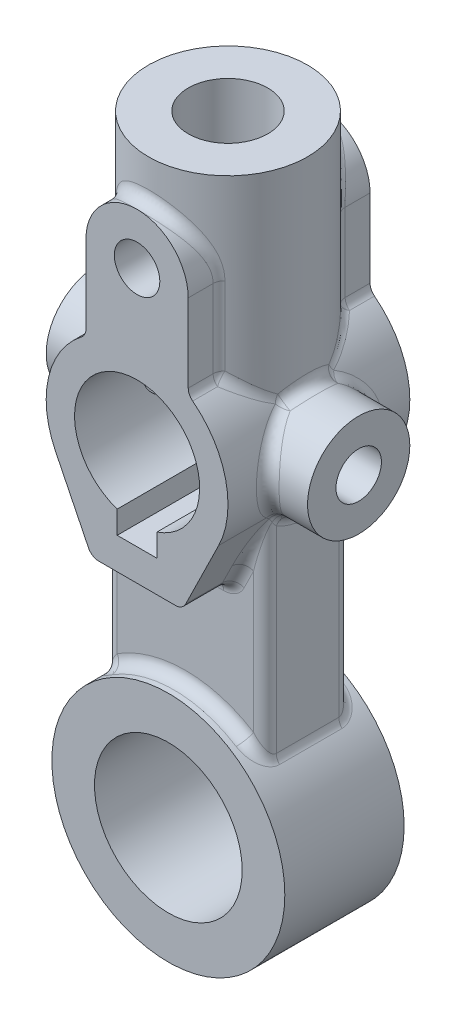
SolidWorks part; units mm, degrees
ref_plane "Front" through (0, 0, 0) normal (0, 0, 1) x (1, 0, 0)
ref_plane "Top" through (0, 0, 0) normal (0, 1, 0) x (1, 0, 0)
ref_plane "Right" through (0, 0, 0) normal (1, 0, 0) x (0, 0, -1)
sketch "Sketch1" plane through (0, 0, 0) normal (0, 0, 1) x (1, 0, 0)
  line L0 (0, 0) -> (0, 44.45) construction
  line L1 (14.2875, 21.0007) -> (14.2875, 44.45)
  line L2 (-14.2875, 21.0007) -> (-14.2875, 44.45)
  line L3 (-12.7, -31.75) -> (12.7, -31.75)
  line L4 (12.7, -31.75) -> (22.7967, -11.2013)
  line L5 (-12.7, -31.75) -> (-22.7967, -11.2013)
  line L6 (0, 0) -> (0, -31.75) construction
  arc A0 (22.7967, -11.2013) -> (14.2875, 21.0007) centre (0, 0) ccw
  arc A1 (-14.2875, 44.45) -> (14.2875, 44.45) centre (0, 44.45) cw
  arc A2 (-14.2875, 21.0007) -> (-22.7967, -11.2013) centre (0, 0) ccw
  dimension "D1" = 14.2875
  dimension "D2" = 44.45
  dimension "D3" = 50.8
  dimension "D4" = 31.75
  dimension "D5" = 25.4
extrude "Base-Extrude" add sketch "Sketch1" along normal mid plane 50.8
sketch "Sketch2" plane through (0, 0, 0) normal (0, 1, 0) x (1, 0, 0)
  circle A0 centre (0, 0) radius 22.225
  dimension "D1" = 44.45
extrude "Boss-Extrude1" add sketch "Sketch2" along normal blind 69.85
sketch "Sketch3" plane through (0, 0, 0) normal (0, 1, 0) x (1, 0, 0)
  line L0 (0, 0) -> (22.225, 0) construction
  line L1 (-22.225, 11.9062) -> (22.225, 11.9062)
  line L2 (-22.225, 11.9062) -> (-22.225, -11.9062)
  line L3 (-22.225, -11.9062) -> (22.225, -11.9062)
  line L4 (22.225, 11.9062) -> (22.225, -11.9062)
  circle A0 centre (0, 0) radius 22.225 construction
  dimension "D1" = 23.8125
extrude "Boss-Extrude2" add sketch "Sketch3" against normal blind 95.25
sketch "Sketch4" plane through (0, 0, 0) normal (0, 0, 1) x (1, 0, 0)
  line L0 (0, 69.85) -> (0, 21.0007) construction
  line L1 (-22.225, -95.25) -> (22.225, -95.25) construction
  circle A0 centre (0, -95.25) radius 32.5437
  dimension "D1" = 65.0875
extrude "Boss-Extrude3" add sketch "Sketch4" along normal mid plane 33.3375
sketch "Sketch5" plane through (0, 0, 0) normal (1, 0, 0) x (0, 0, -1)
  circle A0 centre (0, 0) radius 14.2875
  dimension "D1" = 28.575
extrude "Boss-Extrude4" add sketch "Sketch5" along normal mid plane 73.025
sketch "Sketch7" plane through (0, 0, 0) normal (0, 0, 1) x (1, 0, 0)
  line L0 (0, 0) -> (0, -22.9184) construction
  line L1 (0, 69.85) -> (0, 13.3293) construction
  line L2 (-5.5563, -22.9184) -> (5.5562, -22.9184)
  line L3 (5.5562, -22.9184) -> (5.5562, -16.5684)
  line L4 (-5.5563, -22.9184) -> (-5.5563, -16.5684)
  arc A0 (5.5562, -16.5684) -> (-5.5563, -16.5684) centre (0, 0) ccw
  dimension "D1" = 34.9504
  dimension "D2" = 11.1125
  dimension "D3" = 6.35
extrude "Cut-Extrude2" cut sketch "Sketch7" against normal through all and the other way through all
sketch "Sketch10" plane through (0, 0, 0) normal (0, 0, 1) x (1, 0, 0)
  line L0 (0, 69.85) -> (0, 13.3293) construction
  circle A0 centre (0, 44.45) radius 6.35
  arc A1 (14.2875, 44.45) -> (-14.2875, 44.45) centre (0, 44.45) ccw construction
  dimension "D1" = 12.7
extrude "Cut-Extrude5" cut sketch "Sketch10" against normal through all and the other way through all
sketch "Sketch6" plane through (0, 0, 0) normal (1, 0, 0) x (0, 0, -1)
  circle A0 centre (0, 0) radius 6.35
  dimension "D1" = 12.7
extrude "Cut-Extrude1" cut sketch "Sketch6" against normal through all and the other way through all
sketch "Sketch8" plane through (0, 69.85, 0) normal (0, 1, 0) x (-1, 0, 0)
  circle A0 centre (0, 0) radius 11.1125
  dimension "D1" = 22.225
extrude "Cut-Extrude3" cut sketch "Sketch8" against normal up to next
sketch "Sketch9" plane through (0, 0, 0) normal (0, 0, 1) x (1, 0, 0)
  circle A0 centre (0, -95.25) radius 20.6375
  dimension "D1" = 41.275
extrude "Cut-Extrude4" cut sketch "Sketch9" against normal through all and the other way through all
fillet "Fillet1" radius 3.175 14 edges at (12.7, -31.75, 18.6531) (-12.7, -31.75, 18.6531) (-14.2875, 21.0007, 21.212) (14.2875, 21.0007, 21.212) (-14.2875, 21.0007, -21.212) (-17.2145, 18.6767, -14.0574) (14.2875, 21.0007, -21.212) (18.4937, 17.411, 12.3262) (12.7, -31.75, -18.6531) (-12.7, -31.75, -18.6531) (-22.225, -41.921, 11.9062) (22.225, -41.921, 11.9062) (22.225, -41.921, -11.9062) (-22.225, -41.921, -11.9062)
fillet "Fillet2" radius 3.175 46 edges at (-20.9563, 14.3525, -7.4017) (14.2875, 33.5342, -17.024) (-14.2875, 33.5342, 17.024) (18.4937, 17.411, 12.3262) (14.7317, 20.9987, 16.6411) (14.4549, 21.6009, -16.8821) (-14.4549, 21.6009, 16.8821) (-14.7317, 20.9987, -16.6411) (0, -62.7062, 11.9062) (16.311, -24.4009, 11.9062) (0, -31.75, 11.9062) (-16.311, -24.4009, 11.9062) (22.225, -12.3649, 7.9448) (22.225, -71.4772, 0) (0, -62.7062, -11.9062) (-16.311, -24.4009, -11.9062) (0, -31.75, -11.9062) (16.311, -24.4009, -11.9062) (-22.225, -12.3649, -7.9448) (-22.225, -71.4772, 0) (21.2951, -14.2575, 10.9763) (21.7882, -71.0762, 10.3385) (21.2951, -14.2575, -10.9763) (21.4188, -70.7484, -10.8453) (-21.2951, -14.2575, 10.9763) (-21.4188, -70.7484, 10.8453) (-21.2951, -14.2575, -10.9763) (-21.7882, -71.0762, -10.3385) (-12.401, -31.27, -11.9062) (12.401, -31.27, -11.9062) (-12.401, -31.27, 11.9062) (12.401, -31.27, 11.9062) (14.2875, 33.5342, 17.024) (0.3586, 30.167, -22.2221) (-14.2875, 33.5342, -17.024) (0.3586, 58.733, 22.2221) (20.6956, 14.7259, -8.102) (-20.1, 15.529, 9.4837) (-22.2221, 14.283, -0.3586) (22.1493, 14.1695, -1.8326) (22.225, -12.3649, -7.9448) (-22.225, -12.3649, 7.9448) (22.4956, -11.8141, -8.0349) (24.9685, -4.6617, -13.5056) (-22.4956, -11.8141, 8.0349) (-24.9685, 4.6617, -13.5056)
fillet "Fillet3" radius 3.175 40 edges at (-22.225, -14.2875, 0) (-22.225, -13.1028, 7.2139) (-22.225, -13.1028, -7.2139) (22.6711, -11.4569, -8.5365) (20.6905, -15.4878, -13.2214) (22.5504, -11.7026, -8.4638) (22.225, -14.2875, 0) (22.225, -13.1028, 7.2139) (22.225, -13.1028, -7.2139) (25.3998, 0.1076, -14.2871) (21.7855, 13.1451, 5.5982) (21.7722, 13.4345, -4.8628) (22.2295, -12.9339, 6.0701) (-22.5504, -11.7026, -8.4638) (-22.6711, -11.4569, 8.5365) (-22.2221, 14.283, -0.3586) (-25.3998, -0.1076, -14.2871) (-21.782, 13.49, 4.7067) (-21.7855, 13.1451, -5.5982) (-22.2295, -12.9339, -6.0701) (-20.6905, -15.4878, 13.2214) (-22.5504, -11.7026, 8.4638) (22.5504, -11.7026, 8.4638) (-19.6272, 17.7025, 10.4271) (19.6272, 17.7025, -10.4271) (-18.4369, 17.4711, -14.6611) (-21.2951, -16.888, -10.9763) (21.2951, -16.888, 10.9763) (18.4369, 17.4711, 14.6611) (-22.3074, -12.384, -8.7312) (22.3074, -12.384, -8.7312) (22.3074, -12.384, 8.7312) (-22.3074, -12.384, 8.7312) (25.3998, 0.1076, -14.2871) (22.6711, -11.4569, 8.5365) (-25.3998, -0.1076, -14.2871) (-22.6711, -11.4569, -8.5365)
